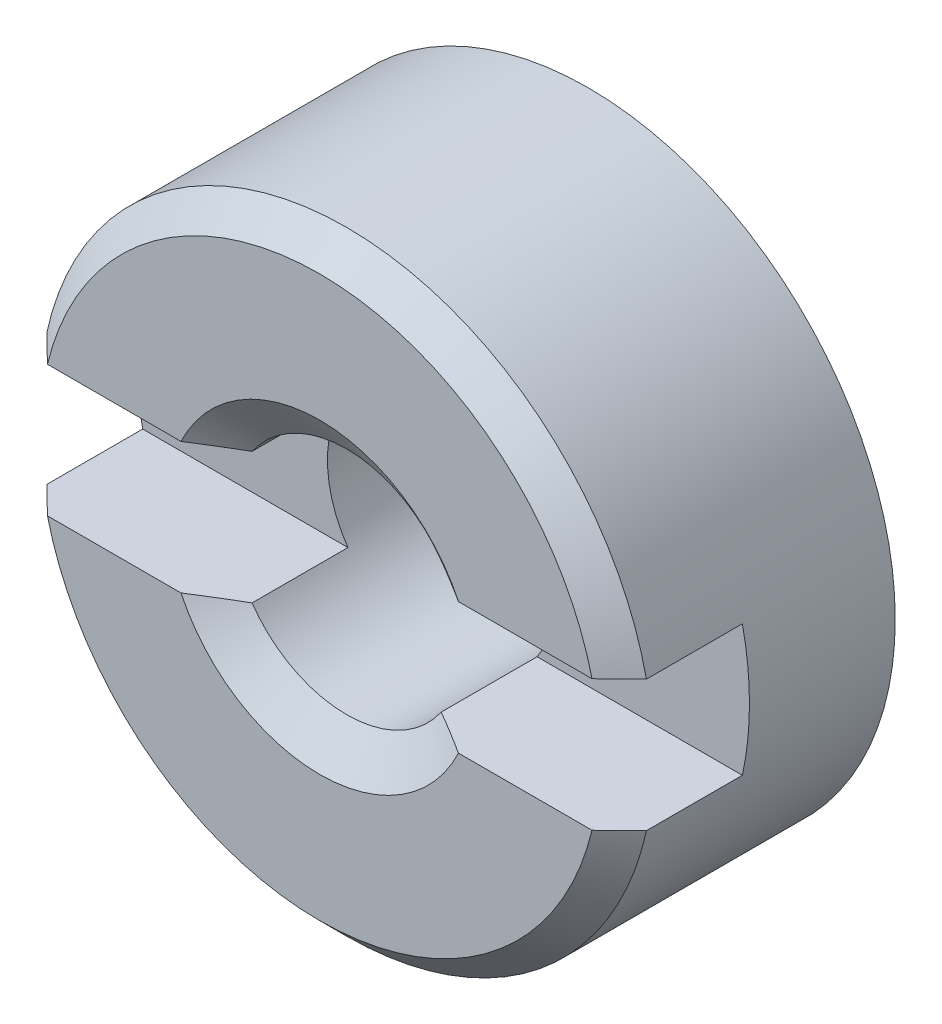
SolidWorks part; units mm, degrees
ref_plane "Plane1" through (0, 0, 0) normal (0, 0, 1) x (1, 0, 0)
ref_plane "Plane2" through (0, 0, 0) normal (0, 1, 0) x (1, 0, 0)
ref_plane "Plane3" through (0, 0, 0) normal (1, 0, 0) x (0, 0, -1)
sketch "BaseNutSke" plane through (0, 0, 0) normal (0, 0, 1) x (1, 0, 0)
  circle A0 centre (0, 0) radius 1.5
  circle A1 centre (0, 0) radius 4
  dimension "Tap_drill" = 3
  dimension "Outerdia" = 8
extrude "BaseNut" add sketch "BaseNutSke" against normal blind 3.5
sketch "EndChSke"
  line L0 (3.4746, 2) -> (3.0895, 1.45)
  line L1 (3.5254, 2) -> (3.4746, 2)
  line L2 (3.5254, 2) -> (3.5254, 1.45)
  line L3 (3.5254, 1.45) -> (3.0895, 1.45)
  line L6 (-0.0508, 2) -> (0, 2)
  line L7 (0, 2) -> (0.3851, 1.45)
  line L9 (0.3851, 1.45) -> (-0.0508, 1.45)
  line L10 (-0.0508, 1.45) -> (-0.0508, 2)
  line L11 (25.0375, 0) -> (38.388, 0) construction
  line L12 (3.5, 0) -> (0, 0) construction
pattern_linear "ThdSchPat" [suppressed]
revolve "ThreadSchematic" cut sketch "ThdSchSke" angle 360 about L6
sketch "ThdSchSke" plane through (0, 0, 0) normal (0, 1, 0) x (1, 0, 0)
  line L0 (-2, 0.025) -> (-1.5, 0.3751)
  line L1 (-1.5, 0.3751) -> (-0.75, 0.3751)
  line L2 (-0.75, 0.3751) -> (-0.75, -0.3251)
  line L3 (-0.75, -0.3251) -> (-1.5, -0.3251)
  line L4 (-1.5, -0.3251) -> (-2, 0.025)
  line L5 (-3.175, 0.525) -> (3.175, 0.525) construction
  line L6 (0, 0.525) -> (0, 6.35) construction
  line L7 (0, 1.6) -> (0, 0.3501) construction
  dimension "D1" = 0.025
  dimension "VeeAngle" = 70
  dimension "SideAngle" = 235
  dimension "OverCut" = 1.5
  dimension "Tap_Drill" = 3
  dimension "Advance" = 1
  dimension "Thread_major" = 4
revolve "EndChamfer" cut sketch "EndChSke" angle 360 about L11
chamfer "Chamfer1" distance 0.35 angle 45 1 edges at (4, 0, 0)
sketch "SlotSke" plane through (0, 0, 0) normal (1, 0, 0) x (0, 0, -1)
  line L0 (0, 0.855) -> (1.6, 0.855)
  line L1 (1.6, 0.855) -> (1.6, -0.855)
  line L3 (1.6, -0.855) -> (0, -0.855)
  line L4 (0, 3.65) -> (0, -3.65) construction
  line L5 (0, 0.855) -> (0, -0.855)
  dimension "Slot_thick" = 1.71
  dimension "Slot_dep" = 1.6
  dimension "HalfSlot_thick" = 0.855
extrude "Cut-Extrude1" cut sketch "SlotSke" against normal through all and the other way through all
equation "\"Tap_drill@ThdSchSke\" = \"Tap_drill@BaseNutSke\""
equation "\"Overcut@ThdSchSke\" = \"Tap_drill@ThdSchSke\" * 0.5"
equation "\"Num_threads@ThdSchPat\" = int(  ( \"Thickness@BaseNut\" - 0.0508 ) / \"Advance@ThdSchSke\" + 0.999 )  + 1"
equation "\"Advance@ThdSchPat\" = ( \"Thickness@BaseNut\" - 0.0508 ) /  (\"Num_threads@ThdSchPat\" - 1) 'relax it"
equation "' \"Num_threads@ThdSchPat\" = \"Num_threads@ThdSchPat\" - sgn( \"Num_threads@ThdSchPat\" - 1) '---chamfered tips only---"
equation "\"ThreadMajor@EndChSke\" = \"Thread_major@ThdSchSke\" * 0.5"
equation "\"ChamferDepth@EndChSke\" = (\"Thread_major@ThdSchSke\" - \"Tap_drill@BaseNutSke\") * 0.55"
equation "\"Offset1@EndChSke\" = \"Thickness@BaseNut\" + 0.0254"
equation "\"Offset2@EndChSke\" = \"Offset1@EndChSke\" + 0.0508"
equation "\"Chamfer_len@Chamfer1\" = 0.1 * \"Thickness@BaseNut\""
equation "\"HalfSlot_thick@SlotSke\" = \"Slot_thick@SlotSke\" / 2"
